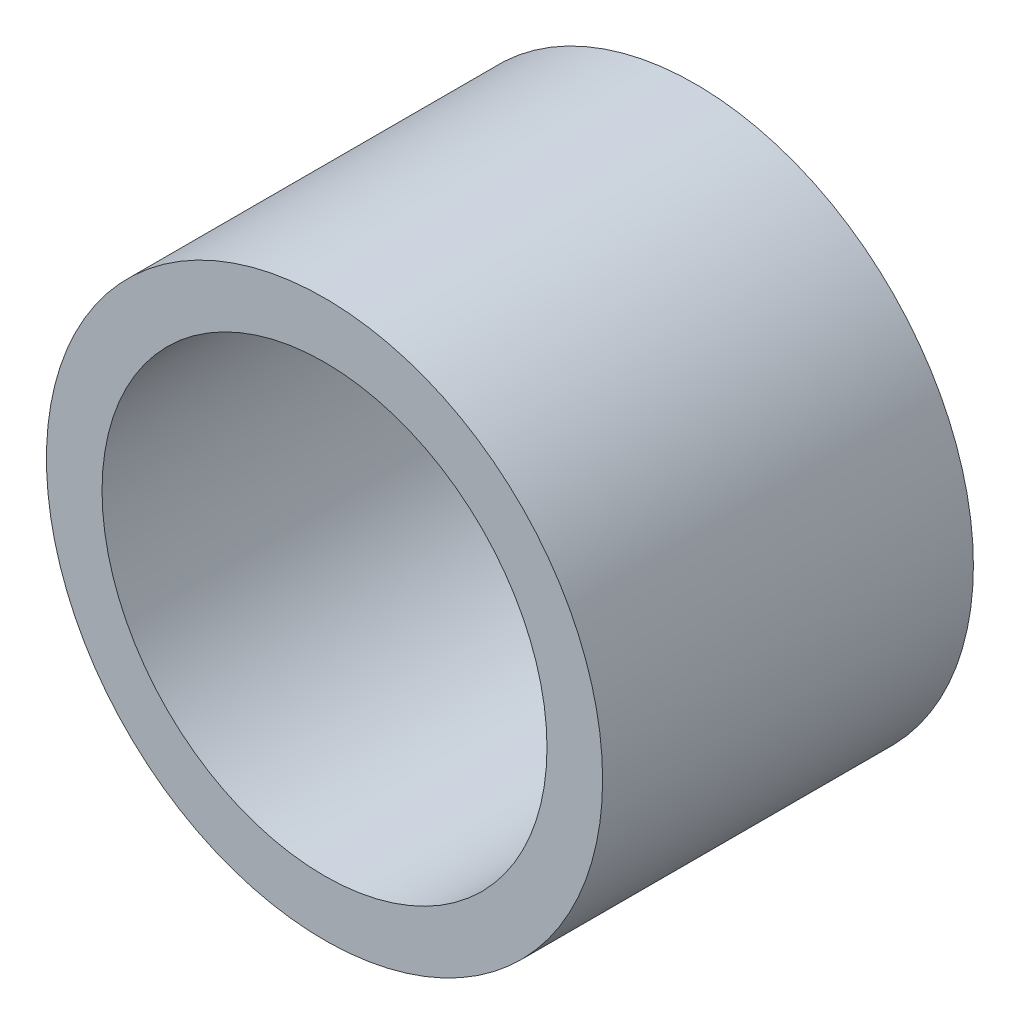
SolidWorks part; units mm, degrees
ref_plane "Front Plane" through (0, 0, 0) normal (0, 0, 1) x (1, 0, 0)
ref_plane "Top Plane" through (0, 0, 0) normal (0, 1, 0) x (1, 0, 0)
ref_plane "Right Plane" through (0, 0, 0) normal (1, 0, 0) x (0, 0, -1)
sketch "Sketch1" plane through (0, 0, 0) normal (0, 0, 1) x (1, 0, 0)
  circle A0 centre (0, 0) radius 38.1
  circle A1 centre (0, 0) radius 30.48
  dimension "D1" = 76.2
  dimension "D2" = 60.96
extrude "Extrude1" add sketch "Sketch1" along normal mid plane 50.8
